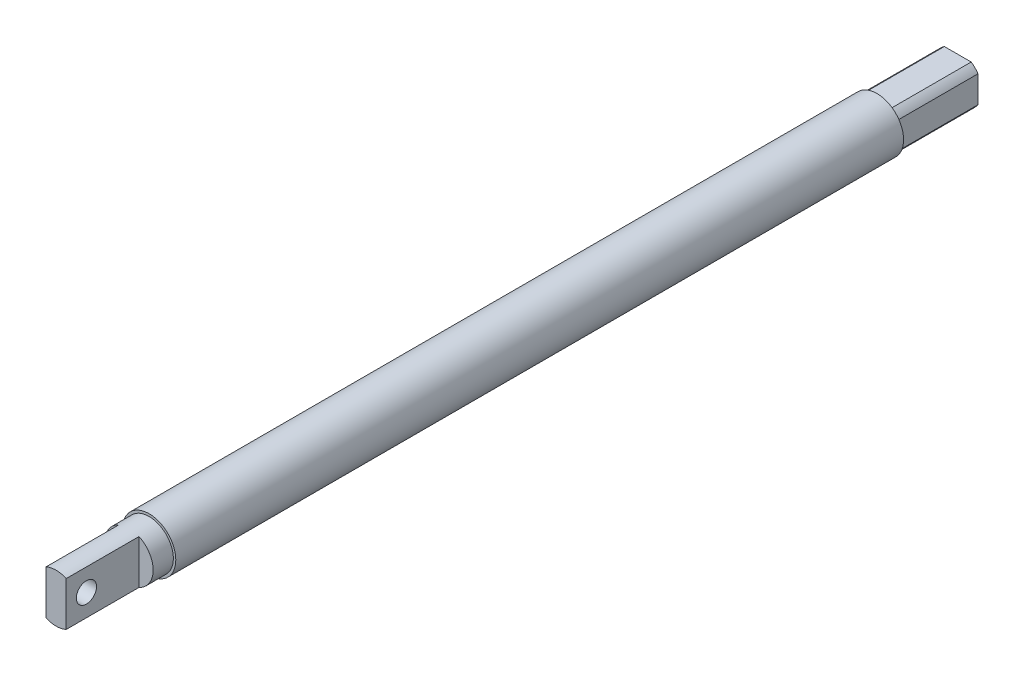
SolidWorks part; units mm, degrees
ref_plane "Front Plane" through (0, 0, 0) normal (0, 0, 1) x (1, 0, 0)
ref_plane "Top Plane" through (0, 0, 0) normal (0, 1, 0) x (1, 0, 0)
ref_plane "Right Plane" through (0, 0, 0) normal (1, 0, 0) x (0, 0, -1)
sketch "Sketch1" plane through (0, 0, 0) normal (0, 0, 1) x (1, 0, 0)
  line L0 (0, 13.8854) -> (0, -12.563) construction
  line L1 (-4.2121, 6.35) -> (4.2121, 6.35)
  line L2 (-6.35, 4.2121) -> (-6.35, -4.2121)
  line L3 (-4.2121, -6.35) -> (4.2121, -6.35)
  line L4 (6.35, 4.2121) -> (6.35, -4.2121)
  line L5 (-8.8168, 0) -> (14.3255, 0) construction
  arc A0 (4.2121, -6.35) -> (6.35, -4.2121) centre (0, 0) ccw
  circle A1 centre (0, 0) radius 3.175
  arc A2 (-6.35, -4.2121) -> (-4.2121, -6.35) centre (0, 0) ccw
  arc A3 (-4.2121, 6.35) -> (-6.35, 4.2121) centre (0, 0) ccw
  arc A4 (6.35, 4.2121) -> (4.2121, 6.35) centre (0, 0) ccw
  dimension "D1" = 6.35
  dimension "D2" = 15.24
  dimension "D3" = 6.35
  dimension "D4" = 6.35
extrude "Extrude1" add sketch "Sketch1" along normal blind 25.4
sketch "Sketch2" plane through (0, 0, 25.4) normal (0, 0, 1) x (1, 0, 0)
  circle A1 centre (0, 0) radius 8.382
  circle A2 centre (0, 0) radius 6.985
  dimension "D2" = 13.97
  dimension "D1" = 1.397
extrude "Extrude2" add sketch "Sketch2" along normal blind 228.6
sketch "Sketch3" plane through (0, 0, 254) normal (0, 0, 1) x (1, 0, 0)
  circle A2 centre (0, 0) radius 7.62
  dimension "D1" = 15.24
extrude "Extrude3" add sketch "Sketch3" along normal blind 29.21
sketch "Sketch5" plane through (0, 0, 0) normal (0, 1, 0) x (1, 0, 0)
  line L0 (0, 0) -> (0, -339.3974) construction
  line L1 (3.175, -260.35) -> (17.1506, -260.35)
  line L2 (3.175, -260.35) -> (3.175, -285.75)
  line L3 (3.175, -285.75) -> (17.1506, -285.75)
  line L4 (17.1506, -260.35) -> (17.1506, -285.75)
  line L5 (-7.62, -283.21) -> (7.62, -283.21) construction
  dimension "D1" = 3.175
  dimension "D2" = 25.4
  dimension "D3" = 2.54
extrude "Cut-Extrude2" cut sketch "Sketch5" against normal through all and the other way through all
mirror "Mirror1" about plane through (0, 0, 0) normal (1, 0, 0) of "Cut-Extrude2"
sketch "Sketch4" plane through (0, 0, 0) normal (1, 0, 0) x (0, 0, -1)
  line L0 (-283.21, 7.62) -> (-283.21, -7.62) construction
  circle A0 centre (-276.86, 0) radius 3.175
  dimension "D1" = 6.35
  dimension "D2" = 6.35
extrude "Cut-Extrude1" cut sketch "Sketch4" against normal through all and the other way through all
sketch3d "3DSketch1"
  circle A0 centre (3.175, 0, 276.86) radius 3.175 construction
  point P0 (3.175, 0, 276.86)
  point P4 (0, 0, 276.86)
  point P9 (0, 0, 276.86)
sketch "Sketch6" plane through (0, 0, 0) normal (0, 0, 1) x (1, 0, 0)
  line L1 (0, 9.3668) -> (8.7208, 9.3668)
  line L2 (0, 9.3668) -> (0, 0)
  line L3 (0, 0) -> (8.7208, 0)
  line L4 (8.7208, 9.3668) -> (8.7208, 0)
ref_point "Point1"
sketch "Sketch7" [suppressed] plane through (0, 0, 254) normal (0, 0, -1) x (-1, 0, 0)
  point P0 (0, 0)
